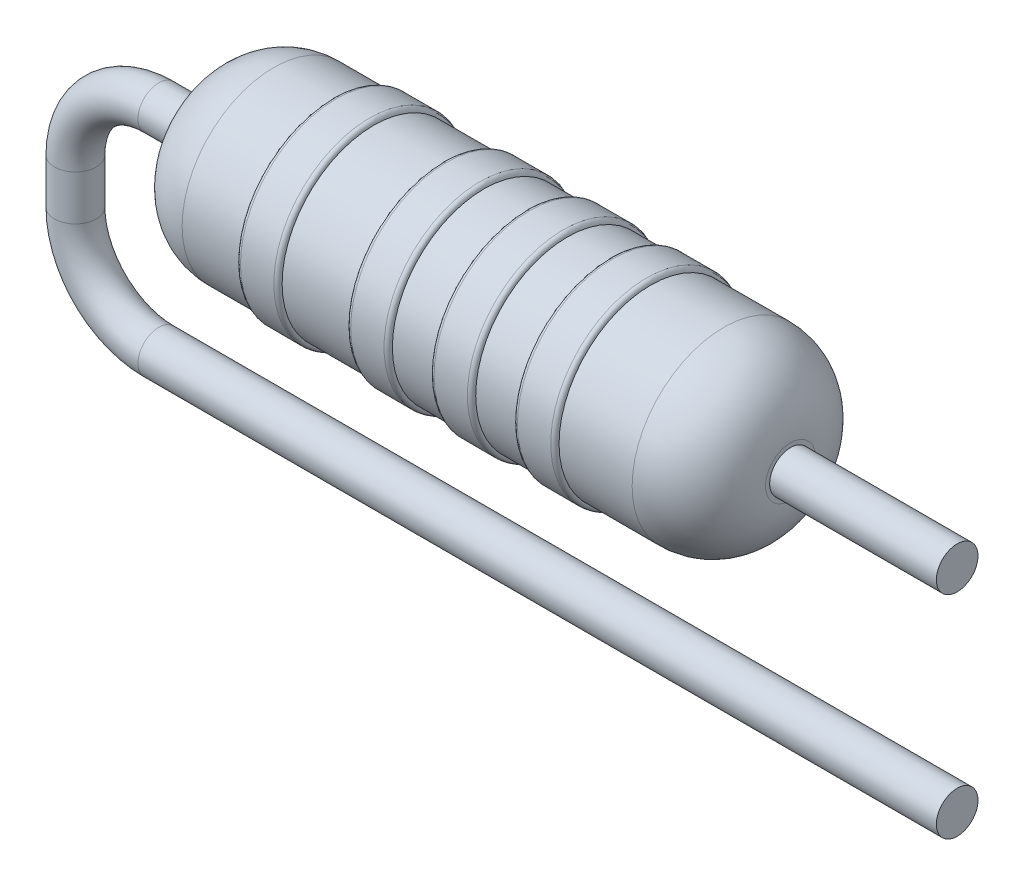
SolidWorks part; units mm, degrees
ref_plane "Face" through (0, 0, 0) normal (0, 0, 1) x (1, 0, 0)
ref_plane "Dessus" through (0, 0, 0) normal (0, 1, 0) x (1, 0, 0)
ref_plane "Droite" through (0, 0, 0) normal (1, 0, 0) x (0, 0, -1)
sketch "Esquisse1" plane through (0, 0, 0) normal (0, 0, 1) x (1, 0, 0)
  line L0 (-54.2687, 0) -> (62.1733, 0) construction
  line L1 (-48.4922, 1.1) -> (45.7559, 1.1) construction
  line L2 (-3.5, -1.6411) -> (-3.5, 4.3175) construction
  line L3 (0, -1.0268) -> (0, 4.1947) construction
  line L4 (3.5, 3.6009) -> (3.5, -1.9687) construction
  line L5 (-3.5, 0) -> (-3.5, 0.3)
  line L6 (-2.7, 1.1) -> (2.7, 1.1)
  line L7 (3.5, 0.3) -> (3.5, 0)
  line L8 (3.5, 0) -> (-3.5, 0)
  arc A0 (-2.7, 1.1) -> (-3.5, 0.3) centre (-2.7, 0.3) ccw
  arc A1 (3.5, 0.3) -> (2.7, 1.1) centre (2.7, 0.3) ccw
revolve "Base-Révolution" add sketch "Esquisse1" angle 360 about L0
sketch "Esquisse2" plane through (0, 0, 0) normal (0, 0, 1) x (1, 0, 0)
  line L0 (-3.3896, 1.15) -> (3.161, 1.15) construction
  line L1 (-2, 1.3889) -> (-2, -0.1179) construction
  line L2 (-1.5, 1.4925) -> (-1.5, -0.2136) construction
  line L3 (4.3262, 0) -> (-3.8651, 0) construction
  line L4 (1.323, 0) -> (1.823, 0)
  line L5 (0.323, 0) -> (0.823, 0)
  line L6 (-0.677, 1.15) -> (-0.677, 0)
  line L7 (0.323, 1.15) -> (0.323, 0)
  line L8 (1.323, 1.15) -> (1.323, 0)
  line L9 (-0.177, 1.15) -> (-0.177, 0)
  line L10 (0.823, 1.15) -> (0.823, 0)
  line L11 (1.823, 1.15) -> (1.823, 0)
  line L12 (-0.677, 0) -> (-0.177, 0)
  line L13 (-0.677, 1.15) -> (-0.177, 1.15)
  line L14 (0.323, 1.15) -> (0.823, 1.15)
  line L15 (1.323, 1.15) -> (1.823, 1.15)
  line L16 (-2, 1.15) -> (-1.5, 1.15)
  line L17 (-1.5, 1.15) -> (-1.5, 0)
  line L18 (-1.5, 0) -> (-2, 0)
  line L19 (-2, 0) -> (-2, 1.15)
revolve "Boss.-Révol.1" add sketch "Esquisse2" angle 360 about L3
fillet "Congé1" radius 0.05 8 edges at (-0.177, 0, -1.15) (-0.677, 0, -1.15) (0.823, 0, -1.15) (0.323, 0, -1.15) (1.823, 0, -1.15) (1.323, 0, -1.15) (-1.5, 0, -1.15) (-2, 0, -1.15)
sketch "Esquisse3" plane through (-3.5, 0, 0) normal (-1, 0, 0) x (0, 0, 1)
  circle A0 centre (0, 0) radius 0.25
sketch "Esquisse4" plane through (0, 0, 0) normal (0, 0, 1) x (1, 0, 0)
  line L0 (-3.1075, 0) -> (-5.8186, 0) construction
  line L1 (0, -2.524) -> (0, 3.2043) construction
  line L2 (-5.9326, -2.54) -> (6.9281, -2.54) construction
  line L3 (-5.08, 1.6795) -> (-5.08, -3.4934) construction
  line L4 (-3.5, 0) -> (-4.08, 0)
  line L5 (3.5, -0.8657) -> (3.5, -3.4091) construction
  line L6 (5.5, -0.8657) -> (5.5, -3.4091) construction
  line L7 (-5.08, -1) -> (-5.08, -1.54)
  line L8 (-4.08, -2.54) -> (5.5, -2.54)
  arc A0 (-5.08, -1) -> (-4.08, 0) centre (-4.08, -1) cw
  arc A1 (-5.08, -1.54) -> (-4.08, -2.54) centre (-4.08, -1.54) ccw
  dimension "D3" = 1
  dimension "D5" = 1
  dimension "D1" = 2.54
  dimension "D2" = 5.08
  dimension "D4" = 2
sweep "Balayage1" add profiles "Esquisse3" path "Esquisse4"
ref_plane "Plan1" through (0, 0, 0) normal (1, 0, 0) x (0, 0, -1)
sketch "Esquisse5" plane through (3.5, 0, 0) normal (1, 0, 0) x (0, 0, -1)
  circle A0 centre (0, 0) radius 0.25
extrude "Extrusion1" add sketch "Esquisse5" along normal blind 2
